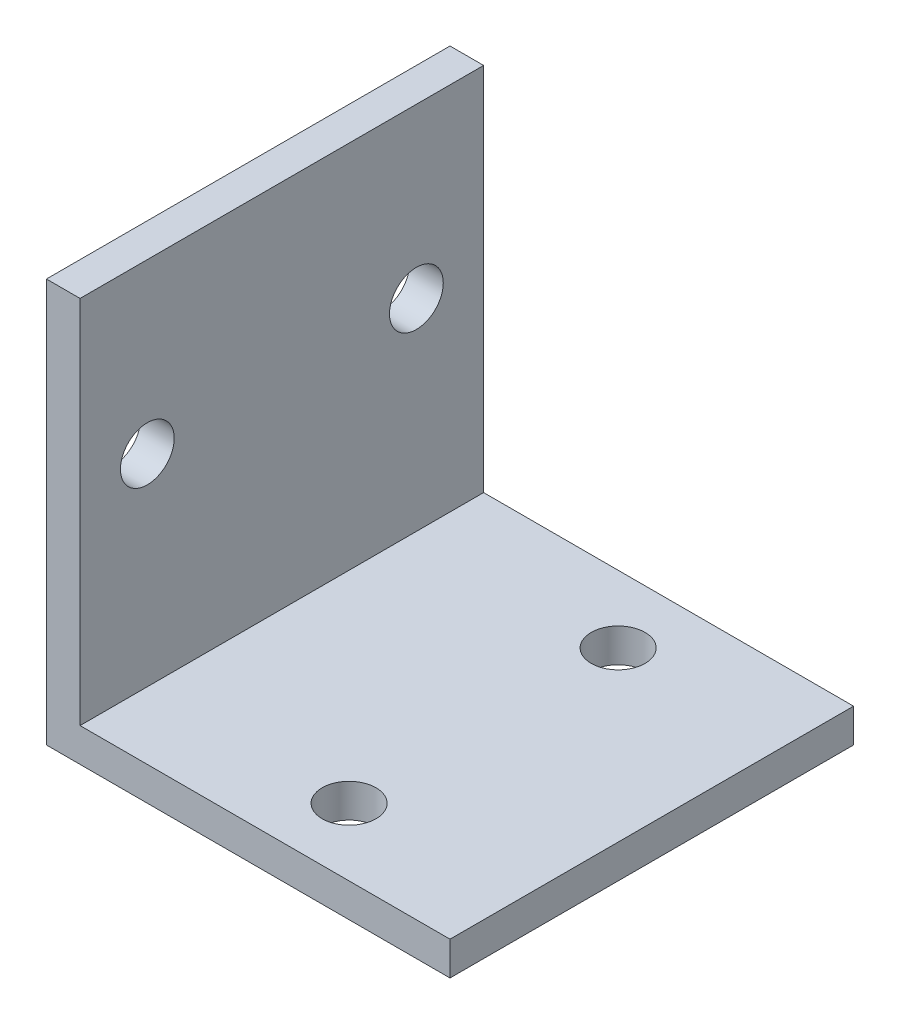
SolidWorks part; units mm, degrees
other "Connection Feature" parameters "D1"=8.5097, "D3"=8.5097, "D2"=60
ref_plane "Front Plane" through (0, 0, 0) normal (0, 0, 1) x (1, 0, 0)
ref_plane "Top Plane" through (0, 0, 0) normal (0, 1, 0) x (1, 0, 0)
ref_plane "Right Plane" through (0, 0, 0) normal (1, 0, 0) x (0, 0, -1)
sketch "Sketch1" plane through (0, 0, 0) normal (0, 0, 1) x (1, 0, 0)
  line L0 (0, 60) -> (0, 0)
  line L1 (0, 0) -> (60, 0)
  line L2 (5, 60) -> (5, 5)
  line L3 (5, 5) -> (60, 5)
  line L4 (0, 60) -> (5, 60)
  line L5 (60, 0) -> (60, 5)
extrude "Boss-Extrude1" add sketch "Sketch1" along normal mid plane 60
sketch "Sketch2" plane through (5, 0, 0) normal (1, 0, 0) x (0, 0, -1)
  line L0 (0, 60) -> (0, 0) construction
  line L1 (-30, 60) -> (30, 60) construction
  line L2 (-30, 5) -> (30, 5) construction
  circle A0 centre (-20, 35) radius 4
  circle A1 centre (20, 35) radius 4
  dimension "D1" = 20
  dimension "D3" = 8
  dimension "D2" = 30
sketch "Sketch3" plane through (0, 5, 0) normal (0, 1, 0) x (1, 0, 0)
  line L0 (60, 0) -> (5, 0) construction
  line L3 (5, -30) -> (5, 30) construction
  line L4 (60, -30) -> (60, 30) construction
  circle A0 centre (35, 20) radius 4
  circle A1 centre (35, -20) radius 4
extrude "Cut-Extrude1" cut sketch "Sketch3" against normal through all
extrude "Cut-Extrude2" cut sketch "Sketch2" against normal through all
